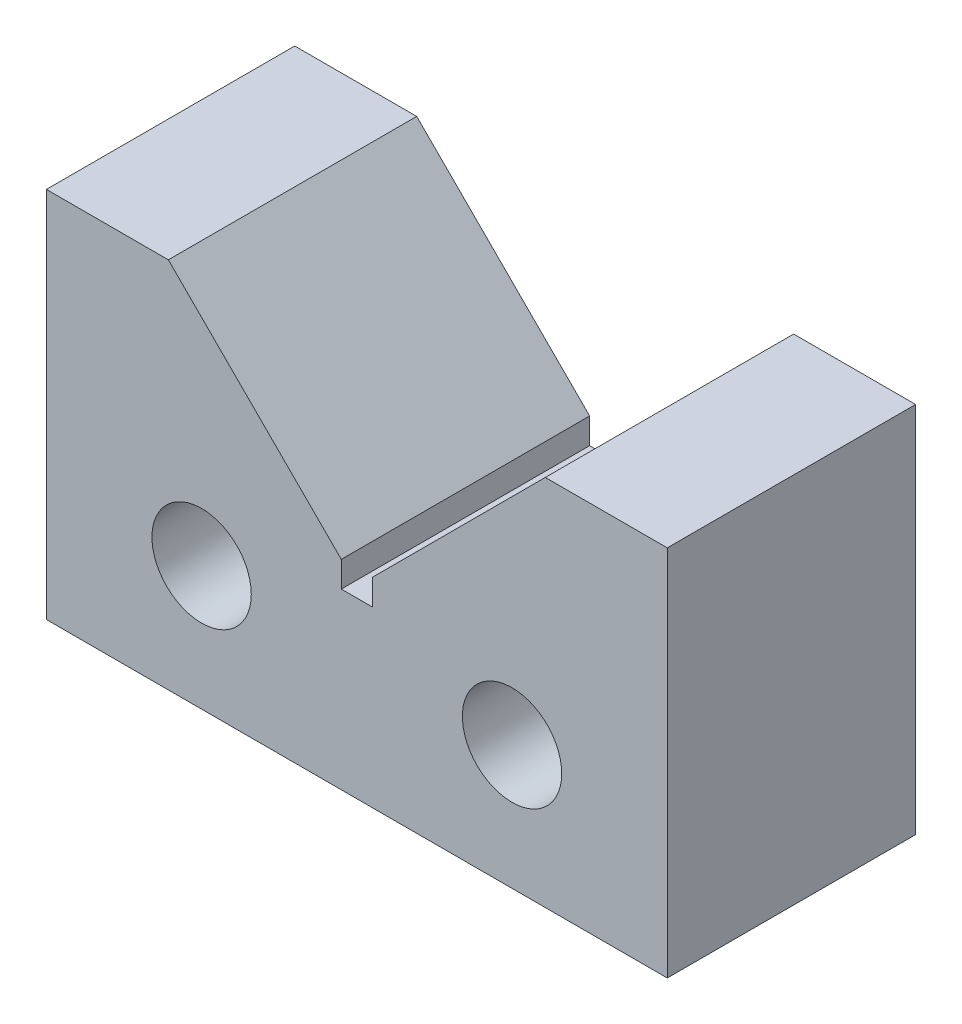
SolidWorks part; units mm, degrees
ref_plane "正面" through (0, 0, 0) normal (0, 0, 1) x (1, 0, 0)
ref_plane "平面" through (0, 0, 0) normal (0, 1, 0) x (1, 0, 0)
ref_plane "右側面" through (0, 0, 0) normal (1, 0, 0) x (0, 0, -1)
sketch "layout1" plane through (0, 0, 0) normal (0, 0, 1) x (1, 0, 0)
  line L0 (0, 0) -> (0, 65) construction
  circle A0 centre (0, 65) radius 25
  dimension "D1" = 50
  dimension "D2" = 65
sketch "layout2" plane through (0, 0, 0) normal (0, 0, 1) x (1, 0, 0)
  line L0 (0, 0) -> (0, 65) construction
  line L1 (0, 29.6447) -> (69.6921, 99.3368)
  line L2 (0, 29.6447) -> (-69.9347, 99.5794)
  circle A0 centre (0, 65) radius 25 construction
  dimension "D1" = 90
sketch "ｽｹｯﾁ3" plane through (0, 0, 0) normal (0, 0, 1) x (1, 0, 0)
  line L1 (-50, 60) -> (50, 60)
  line L2 (-50, 60) -> (-50, 0)
  line L3 (-50, 0) -> (50, 0)
  line L4 (50, 60) -> (50, 0)
  dimension "D1" = 100
  dimension "D2" = 60
extrude "押し出し1" add sketch "ｽｹｯﾁ3" along normal blind 40
sketch "ｽｹｯﾁ4" plane through (0, 0, 0) normal (0, 0, 1) x (1, 0, 0)
  line L0 (0, 29.6447) -> (-69.9347, 99.5794) construction
  line L1 (0, 29.6447) -> (69.6921, 99.3368) construction
  line L2 (0, 29.6447) -> (-69.9347, 99.5794)
  line L3 (0, 29.6447) -> (69.6921, 99.3368)
extrude "ｶｯﾄ - 押し出し1" cut sketch "ｽｹｯﾁ4" against normal through all and the other way through all
sketch "ｽｹｯﾁ5" plane through (0, 0, 40) normal (0, 0, 1) x (1, 0, 0)
  line L0 (-2.5, 32.1447) -> (2.5, 32.1447)
  line L1 (0, 29.6447) -> (-69.9347, 99.5794) construction
  line L2 (0, 29.6447) -> (69.6921, 99.3368) construction
  line L3 (2.5, 32.1447) -> (2.5, 28)
  line L4 (2.5, 28) -> (-2.5, 28)
  line L5 (-2.5, 28) -> (-2.5, 32.1447)
  line L6 (-50, 0) -> (50, 0) construction
  dimension "D1" = 5
  dimension "D2" = 28
extrude "ｶｯﾄ - 押し出し2" cut sketch "ｽｹｯﾁ5" against normal through all
sketch "ｽｹｯﾁ6" plane through (0, 0, 40) normal (0, 0, 1) x (1, 0, 0)
  line L0 (0, 0) -> (0, 20) construction
  line L1 (0, 0) -> (0, 65) construction
  line L2 (-25, 20) -> (25, 20) construction
  line L3 (-50, 0) -> (50, 0) construction
  circle A0 centre (-25, 20) radius 8
  circle A1 centre (25, 20) radius 8
  dimension "D1" = 16
  dimension "D2" = 50
  dimension "D3" = 20
extrude "ｶｯﾄ - 押し出し3" cut sketch "ｽｹｯﾁ6" against normal through all
